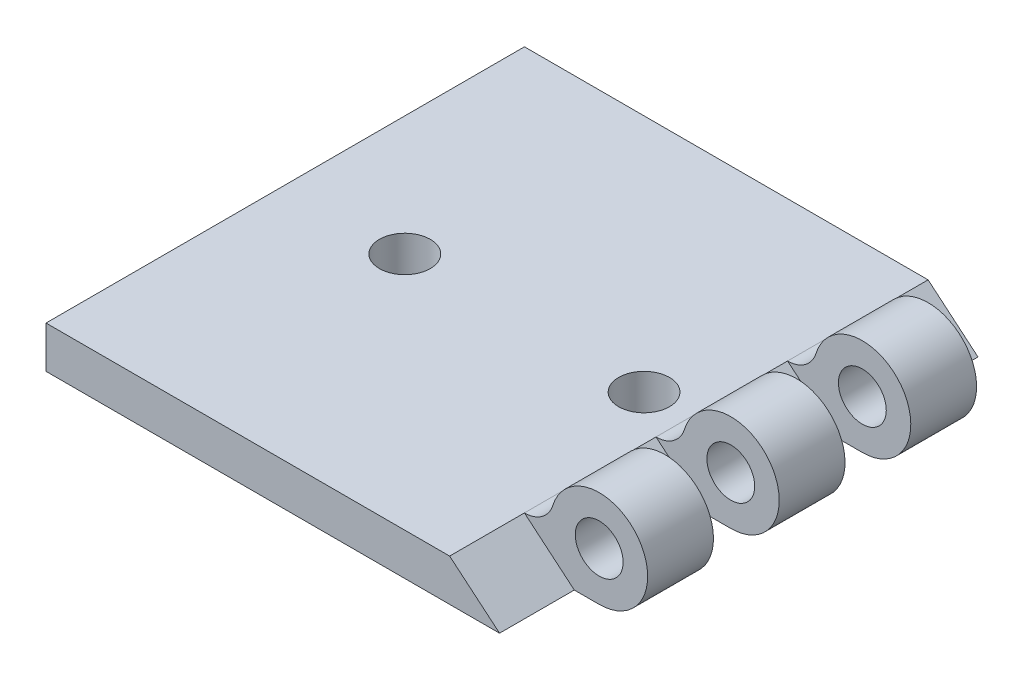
SolidWorks part; units mm, degrees
ref_plane "Ebene vorne" through (0, 0, 0) normal (0, 0, 1) x (1, 0, 0)
ref_plane "Ebene oben" through (0, 0, 0) normal (0, 1, 0) x (1, 0, 0)
ref_plane "Ebene rechts" through (0, 0, 0) normal (1, 0, 0) x (0, 0, -1)
sketch "Skizze1" plane through (0, 0, 0) normal (0, 0, 1) x (1, 0, 0)
  line L0 (0, 0) -> (-80, 0)
  line L1 (-80, 0) -> (-80, 7)
  line L2 (-80, 7) -> (-12.506, 7)
  arc A0 (0, 0) -> (-7.7327, 10.5115) centre (0, 8.1) ccw
  arc A1 (-7.7327, 10.5115) -> (-12.506, 7) centre (-12.506, 12) cw
  circle A2 centre (0, 8.1) radius 4
  point P9 (0, 0)
  dimension "D2" = 8.1
  dimension "D3" = 5
  dimension "D4" = 8
  dimension "D1" = 7
  dimension "D5" = 80
extrude "Linear austragen1" add sketch "Skizze1" along normal blind 80
ref_plane "Ebene1" through (-10.7856, 9.0502, 0) normal (0.766, -0.6428, 0) x (0, 0, 1)
sketch "Skizze2" plane through (-10.7856, 9.0502, 0) normal (0.766, -0.6428, 0) x (0, 0, 1)
  line L0 (80, 2.6764) -> (0, 2.6764) construction
  line L1 (67.5, 2.6764) -> (80, 2.6764)
  line L2 (67.5, 2.6764) -> (67.5, -24.0694)
  line L3 (56.5, -24.0694) -> (45.5, -24.0694)
  line L4 (56.5, 2.6764) -> (56.5, -24.0694)
  line L5 (80, -14.305) -> (80, 0) construction
  line L6 (45.5, 2.6764) -> (56.5, 2.6764)
  line L7 (45.5, 2.6764) -> (45.5, -24.0694)
  line L8 (34.5, -24.0694) -> (23.5, -24.0694)
  line L9 (34.5, 2.6764) -> (34.5, -24.0694)
  line L10 (23.5, 2.6764) -> (34.5, 2.6764)
  line L11 (23.5, 2.6764) -> (23.5, -24.0694)
  line L12 (12.5, -24.0694) -> (0, -24.0694)
  line L13 (12.5, 2.6764) -> (12.5, -24.0694)
  line L14 (0, 0) -> (0, -14.305) construction
  line L16 (80, 2.6764) -> (80, -24.0694)
  line L17 (80, -24.0694) -> (67.5, -24.0694)
  line L18 (0, -24.0694) -> (0, 2.6764)
  line L19 (0, 2.6764) -> (12.5, 2.6764)
  dimension "D1" = 12.5
  dimension "D2" = 12.5
  dimension "D3" = 11
  dimension "D4" = 11
  dimension "D5" = 11
  dimension "D6" = 11
  dimension "D7" = 11
extrude "Schnitt-Linear austragen1" cut sketch "Skizze2" along normal through all
sketch "Skizze3" plane through (0, 0, 0) normal (0, -1, 0) x (1, 0, 0)
  line L0 (-80, 40) -> (8.1, 40) construction
  line L1 (-80, 80) -> (-80, 0) construction
  line L2 (8.1, 34.5) -> (8.1, 45.5) construction
  line L3 (0, 67.5) -> (0, 56.5) construction
  circle A0 centre (-60, 40) radius 4.25
  circle A1 centre (-20, 40) radius 4.25
  point P0 (-20, 40)
  point P1 (-60, 40)
  dimension "D2" = 8.5
  dimension "D1" = 40
  dimension "D3" = 20
extrude "Schnitt-Linear austragen2" cut sketch "Skizze3" against normal through all
